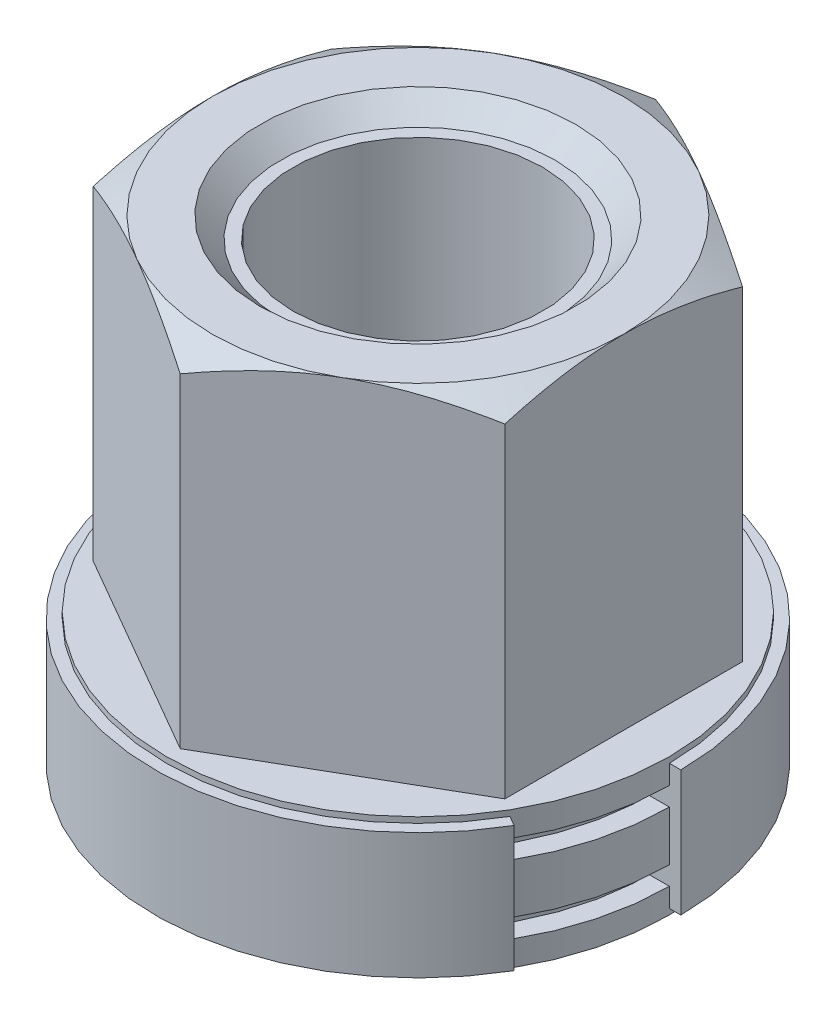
SolidWorks part; units mm, degrees
ref_plane "Plan de face" through (0, 0, 0) normal (0, 0, 1) x (1, 0, 0)
ref_plane "Plan de dessus" through (0, 0, 0) normal (0, 1, 0) x (1, 0, 0)
ref_plane "Plan de droite" through (0, 0, 0) normal (1, 0, 0) x (0, 0, -1)
sketch "Esquisse1" plane through (0, 0, 0) normal (0, 0, 1) x (1, 0, 0)
  line L0 (0, 42) -> (18, 42)
  line L1 (18, 42) -> (20.79, 40.3892)
  line L2 (20.79, 40.3892) -> (20.79, 12)
  line L3 (20.79, 12) -> (22, 12)
  line L4 (22, 12) -> (22, 9.8184)
  line L5 (22, 9.8184) -> (20.24, 9.8184)
  line L6 (20.24, 9.8184) -> (20.24, 8.1821)
  line L7 (20.24, 8.1821) -> (22, 8.1821)
  line L8 (22, 8.1821) -> (22, 3.8189)
  line L9 (22, 3.8189) -> (20.24, 3.8189)
  line L10 (20.24, 3.8189) -> (20.24, 2.1826)
  line L11 (20.24, 2.1826) -> (22, 2.1826)
  line L12 (22, 2.1826) -> (22, 0)
  line L13 (22, 0) -> (0, 0)
  line L14 (0, 0) -> (0, 42)
  line L15 (0, 0) -> (0, 42) construction
revolve "Révolution1" add sketch "Esquisse1" angle 360 about L15
ref_plane "Plan4" through (0, 42, 0) normal (0, 1, 0) x (-1, 0, 0)
sketch "Esquisse2" plane through (0, 42, 0) normal (0, 1, 0) x (-1, 0, 0)
  line L0 (36, 36) -> (-36, 36)
  line L1 (-36, 36) -> (-36, -36)
  line L2 (-36, -36) -> (36, -36)
  line L3 (36, -36) -> (36, 36)
  line L4 (18, -10.3923) -> (18, 10.3923)
  line L5 (18, 10.3923) -> (0, 20.7846)
  line L6 (0, 20.7846) -> (-18, 10.3923)
  line L7 (-18, 10.3923) -> (-18, -10.3923)
  line L8 (-18, -10.3923) -> (0, -20.7846)
  line L9 (0, -20.7846) -> (18, -10.3923)
extrude "Enlèv. mat.-Extru.1" cut sketch "Esquisse2" against normal blind 30.001
sketch "Esquisse3" plane through (0, 0, 0) normal (0, 0, 1) x (1, 0, 0)
  line L0 (20.241, 2.1826) -> (22.001, 2.1826)
  line L1 (22.001, 2.1826) -> (22.001, 0.5)
  line L2 (22.001, 0.5) -> (23, 0.5)
  line L3 (23, 0.5) -> (23, 11.5)
  line L4 (23, 11.5) -> (22.001, 11.5)
  line L5 (22.001, 11.5) -> (22.001, 9.8084)
  line L6 (22.001, 9.8084) -> (20.241, 9.8084)
  line L7 (20.241, 9.8084) -> (20.241, 8.1821)
  line L8 (20.241, 8.1821) -> (22.001, 8.1821)
  line L9 (22.001, 8.1821) -> (22.001, 3.8089)
  line L10 (22.001, 3.8089) -> (20.241, 3.8089)
  line L11 (20.241, 3.8089) -> (20.241, 2.1826)
  line L12 (0, -50) -> (0, 50) construction
revolve "Révolution2" add sketch "Esquisse3" angle 330 about L12
sketch "Esquisse4" plane through (0, 0, 0) normal (1, 0, 0) x (0, 0, -1)
  line L0 (0, 42.001) -> (13.806, 42.001)
  line L1 (13.806, 42.001) -> (12, 40.195)
  line L2 (12, 40.195) -> (10.9175, 40.195)
  line L3 (10.9175, 40.195) -> (10.9175, 7.807)
  line L4 (10.9175, 7.807) -> (12, 7.807)
  line L5 (12, 7.807) -> (13.808, 5.999)
  line L6 (13.808, 5.999) -> (12.25, 5.999)
  line L7 (12.25, 5.999) -> (12.25, -0.001)
  line L8 (12.25, -0.001) -> (0, -0.001)
  line L9 (0, -0.001) -> (0, 42.001)
  line L10 (0, -0.001) -> (0, 42.001) construction
revolve "Enlèvement de matière-Révolution1" cut sketch "Esquisse4" angle 360 about L10
